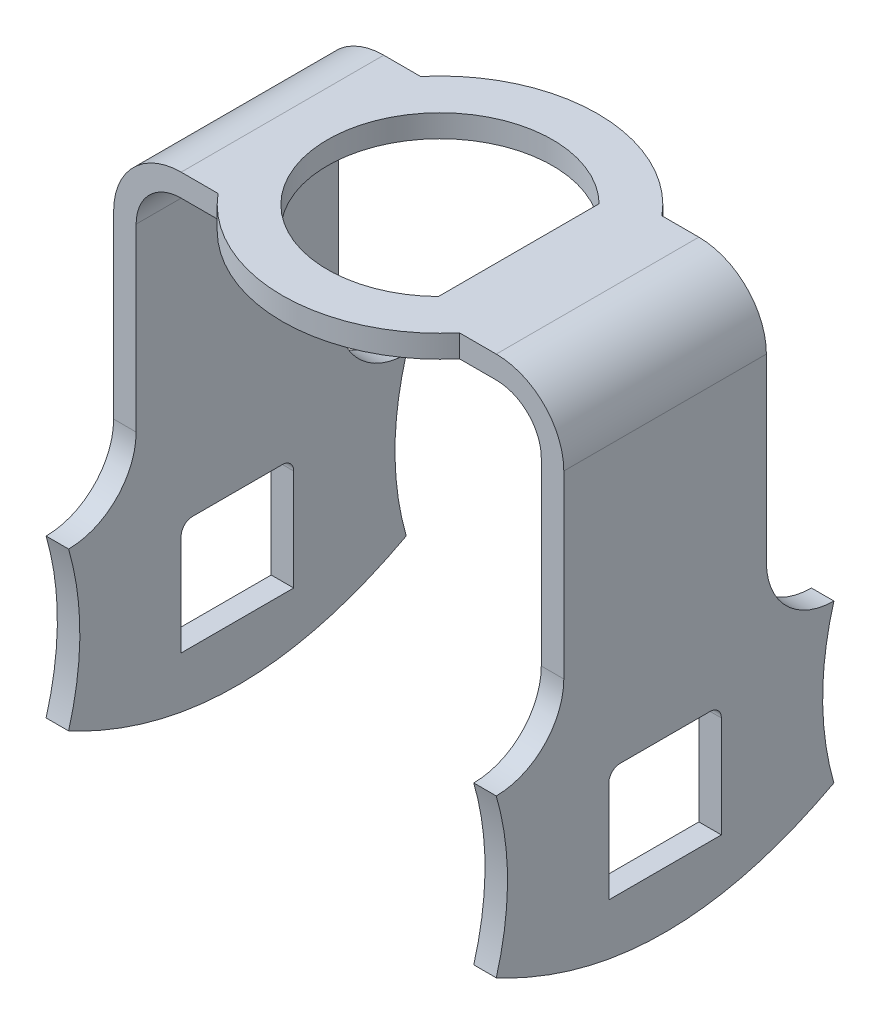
SolidWorks part; units mm, degrees
ref_plane "Front Plane" through (0, 0, 0) normal (0, 0, 1) x (1, 0, 0)
ref_plane "Top Plane" through (0, 0, 0) normal (0, 1, 0) x (1, 0, 0)
ref_plane "Right Plane" through (0, 0, 0) normal (1, 0, 0) x (0, 0, -1)
sketch "Sketch1" plane through (0, 0, 0) normal (0, 0, 1) x (1, 0, 0)
  line L0 (-19, 0) -> (-19, 20)
  line L1 (0, 0) -> (-1, 0)
  line L2 (0, 0) -> (0, 20)
  line L3 (-3, 23) -> (-17, 23)
  line L4 (-20, 0) -> (-20, 20)
  line L5 (-3, 22) -> (-17, 22)
  line L6 (-1, 0) -> (-1, 20)
  line L7 (-19, 0) -> (-20, 0)
  arc A0 (-17, 23) -> (-20, 20) centre (-17, 20) ccw
  arc A1 (0, 20) -> (-3, 23) centre (-3, 20) ccw
  arc A2 (-17, 22) -> (-19, 20) centre (-17, 20) ccw
  arc A3 (-1, 20) -> (-3, 22) centre (-3, 20) ccw
  point P7 (-20, 23)
  point P10 (0, 23)
  dimension "D3" = 3
  dimension "D4" = 3
  dimension "D1" = 23
  dimension "D2" = 20
  dimension "D5" = 1
extrude "Boss-Extrude1" add sketch "Sketch1" along normal blind 15
sketch "Sketch2" plane through (0, 23, 0) normal (0, 1, 0) x (1, 0, 0)
  line L0 (-10, 0) -> (-10, -15) construction
  line L1 (-3, 0) -> (-17, 0) construction
  line L2 (-3, -15) -> (-17, -15) construction
  line L3 (-6.5, -11.0707) -> (-6.5, -3.9293)
  arc A0 (-6.5, -3.9293) -> (-6.5, -11.0707) centre (-10, -7.5) ccw
  dimension "D1" = 10
  dimension "D2" = 3.5
extrude "Cut-Extrude2" cut sketch "Sketch2" against normal through all
sketch "Sketch4" plane through (0, 23, 0) normal (0, 1, 0) x (1, 0, 0)
  line L0 (0, -7.5) -> (-20, -7.5) construction
  line L1 (0, -15) -> (0, 0) construction
  line L2 (-20, -15) -> (-20, 0) construction
  line L3 (-4.6381, -12) -> (0, -12)
  line L4 (-4.6381, -3) -> (0, -3)
  line L5 (-10, 0) -> (-10, -15) construction
  line L6 (-3, 0) -> (-17, 0) construction
  line L7 (-3, -15) -> (-17, -15) construction
  line L8 (-15.3619, -12) -> (-20, -12)
  line L9 (-15.3619, -3) -> (-20, -3)
  line L10 (-20, -3) -> (-20, 0)
  line L11 (-20, 0) -> (0, 0)
  line L12 (0, 0) -> (0, -3)
  line L13 (-20, -12) -> (-20, -15)
  line L14 (-20, -15) -> (0, -15)
  line L15 (0, -15) -> (0, -12)
  arc A0 (-15.3619, -12) -> (-4.6381, -12) centre (-10, -7.5) ccw
  arc A1 (-4.6381, -3) -> (-15.3619, -3) centre (-10, -7.5) ccw
  dimension "D1" = 14
  dimension "D2" = 4.5
  dimension "D3" = 4.5
extrude "Cut-Extrude3" cut sketch "Sketch4" against normal blind 14
sketch "Sketch5" plane through (-20, 0, 0) normal (-1, 0, 0) x (0, 0, 1)
  line L0 (15, 0) -> (0, 0) construction
  line L1 (0, 0) -> (0, 2)
  line L2 (0, 9) -> (0, 0) construction
  line L3 (15, 9) -> (15, 0) construction
  line L4 (0, 2) -> (0, 0)
  line L5 (15, 0) -> (15, 2)
  spline S0 degree 2 poles (0, 2) (7.5, -2) (15, 2) knots 0 0 0 1 1 1
  point P0 (7.5, 0)
  dimension "D1" = 2
  dimension "D2" = 2
extrude "Cut-Extrude4" cut sketch "Sketch5" against normal through all contours S0 M6 M7 | S0 M7 M8
sketch "Sketch6" plane through (-20, 0, 0) normal (-1, 0, 0) x (0, 0, 1)
  line L0 (0, 9) -> (0, 2) construction
  line L1 (0, 5.5) -> (0.5, 5.5)
  line L2 (7.5, 0) -> (7.5, 13.8761) construction
  line L3 (15, 2) -> (15, 9) construction
  line L4 (0, 9) -> (0, 2)
  line L5 (15, 9) -> (15, 2)
  parabola Q0 construction
  spline S0 degree 2 poles (0, 9) (1, 5.5) (0, 2) knots 0 0 0 1 1 1
  spline S1 degree 2 poles (15, 9) (14, 5.5) (15, 2) knots 0 0 0 1 1 1
  point P0 (0, 5.5)
  point P19 (15, 5.5)
  dimension "D1" = 0.5
  dimension "D2" = 0.5
extrude "Cut-Extrude5" cut sketch "Sketch6" against normal through all contours S0 L1 M8 | L5 S1
fillet "Fillet1" radius 3 1 edges at (-19.5, 9, 3)
fillet "Fillet2" radius 3 3 edges at (-0.5, 9, 3) (-0.5, 9, 12) (-19.5, 9, 12)
sketch "Sketch7" plane through (-20, 0, 0) normal (-1, 0, 0) x (0, 0, 1)
  line L1 (5, 7.5) -> (10, 7.5)
  line L2 (5, 7.5) -> (5, 2.5)
  line L3 (5, 2.5) -> (10, 2.5)
  line L4 (10, 7.5) -> (10, 2.5)
  line L5 (0.5, 22) -> (3, 22) construction
  line L6 (7.5, 0) -> (7.5, 15) construction
  parabola Q0 construction
  point P4 (1.75, 22)
  point P13 (7.5, 7.5)
  dimension "D1" = 19.5
  dimension "D2" = 5
  dimension "D3" = 5
extrude "Cut-Extrude6" cut sketch "Sketch7" against normal through all
fillet "Fillet3" radius 0.5 4 edges at (-0.5, 7.5, 10) (-0.5, 7.5, 5) (-19.5, 7.5, 10) (-19.5, 7.5, 5)
